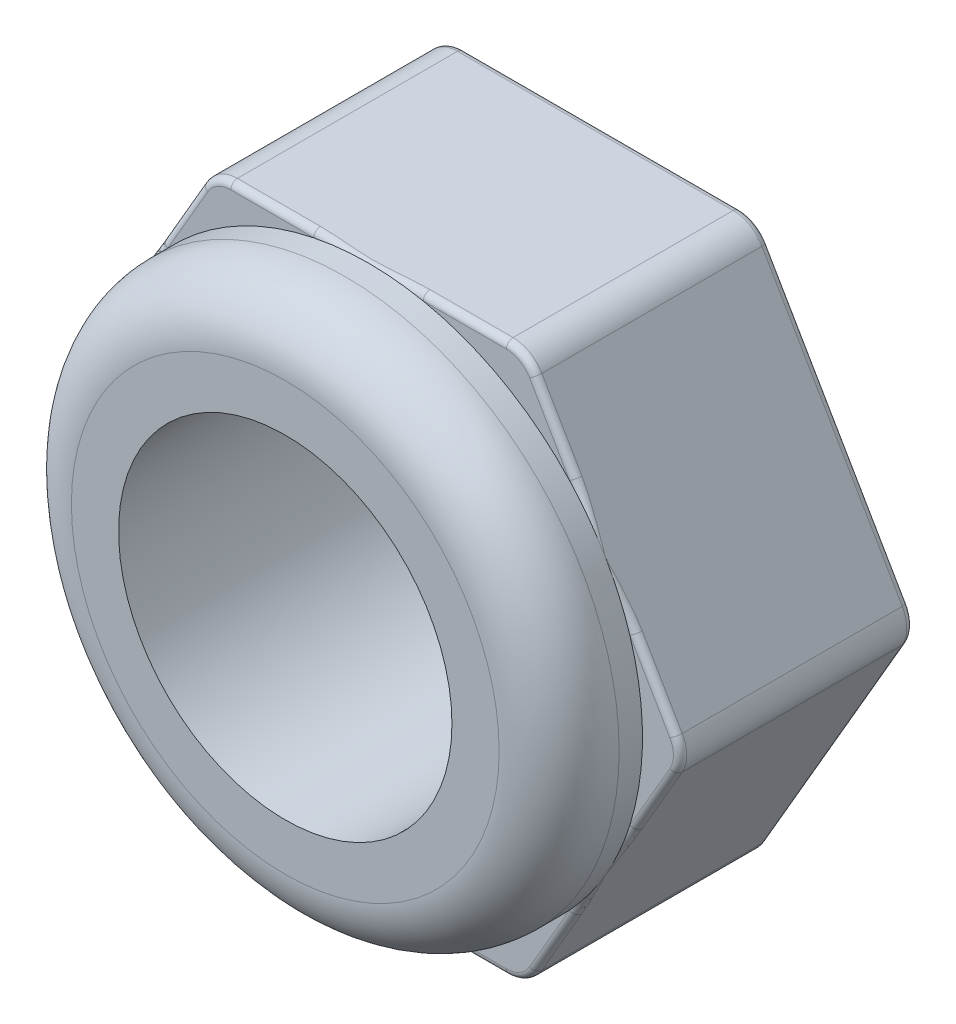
SolidWorks part; units mm, degrees
ref_plane "Plan1" through (0, 0, 0) normal (0, 0, 1) x (1, 0, 0)
ref_plane "Plan2" through (0, 0, 0) normal (0, 1, 0) x (1, 0, 0)
ref_plane "Plan3" through (0, 0, 0) normal (1, 0, 0) x (0, 0, -1)
sketch "Esquisse1" plane through (0, 0, 0) normal (0, 0, 1) x (1, 0, 0)
  line L0 (-9.5, 0) -> (-4.7104, 8.25)
  line L1 (-4.7104, 8.25) -> (4.7104, 8.25)
  line L2 (4.7104, 8.25) -> (9.5, 0)
  line L3 (9.5, 0) -> (4.7104, -8.25)
  line L4 (4.7104, -8.25) -> (-4.7104, -8.25)
  line L5 (-4.7104, -8.25) -> (-9.5, 0)
  line L6 (-48.544, 0) -> (48.544, 0) construction
  line L7 (0, 30.4512) -> (0, -30.4512) construction
  circle A0 centre (0, 0) radius 9.5 construction
  circle A1 centre (0, 0) radius 5
  dimension "D3" = 10
  dimension "D1" = 19
  dimension "D2" = 16.5
extrude "Base-Extrusion" add sketch "Esquisse1" along normal blind 7
sketch "Esquisse2" plane through (0, 0, 7) normal (0, 0, 1) x (1, 0, 0)
  line L0 (-9.5, 0) -> (-4.7104, 8.25) construction
  circle A0 centre (0, 0) radius 8.2158
  circle A1 centre (0, 0) radius 5
  circle A2 centre (0, 0) radius 5 construction
extrude "Boss.-Extru.1" add sketch "Esquisse2" along normal blind 2.5
fillet "Congé1" radius 1.8
fillet "Congé2" radius 1
fillet "Congé3" radius 0.2
